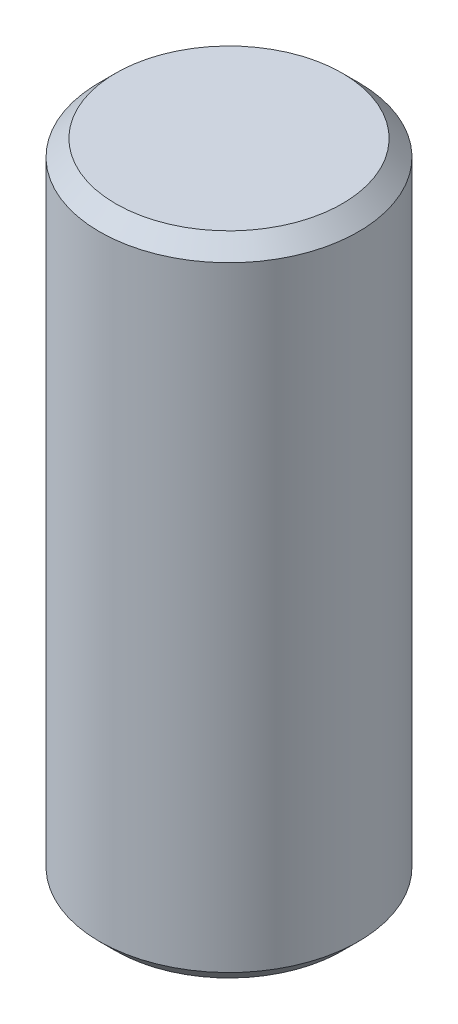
SolidWorks part; units mm, degrees
ref_plane "前视" through (0, 0, 0) normal (0, 0, 1) x (1, 0, 0)
ref_plane "上视" through (0, 0, 0) normal (0, 1, 0) x (1, 0, 0)
ref_plane "右视" through (0, 0, 0) normal (1, 0, 0) x (0, 0, -1)
sketch "草图1" plane through (0, 0, 0) normal (0, 1, 0) x (1, 0, 0)
  circle A0 centre (0, 0) radius 8
  dimension "D1" = 16
extrude "拉伸1" add sketch "草图1" along normal blind 40
chamfer "倒角1" distance 1 angle 45
